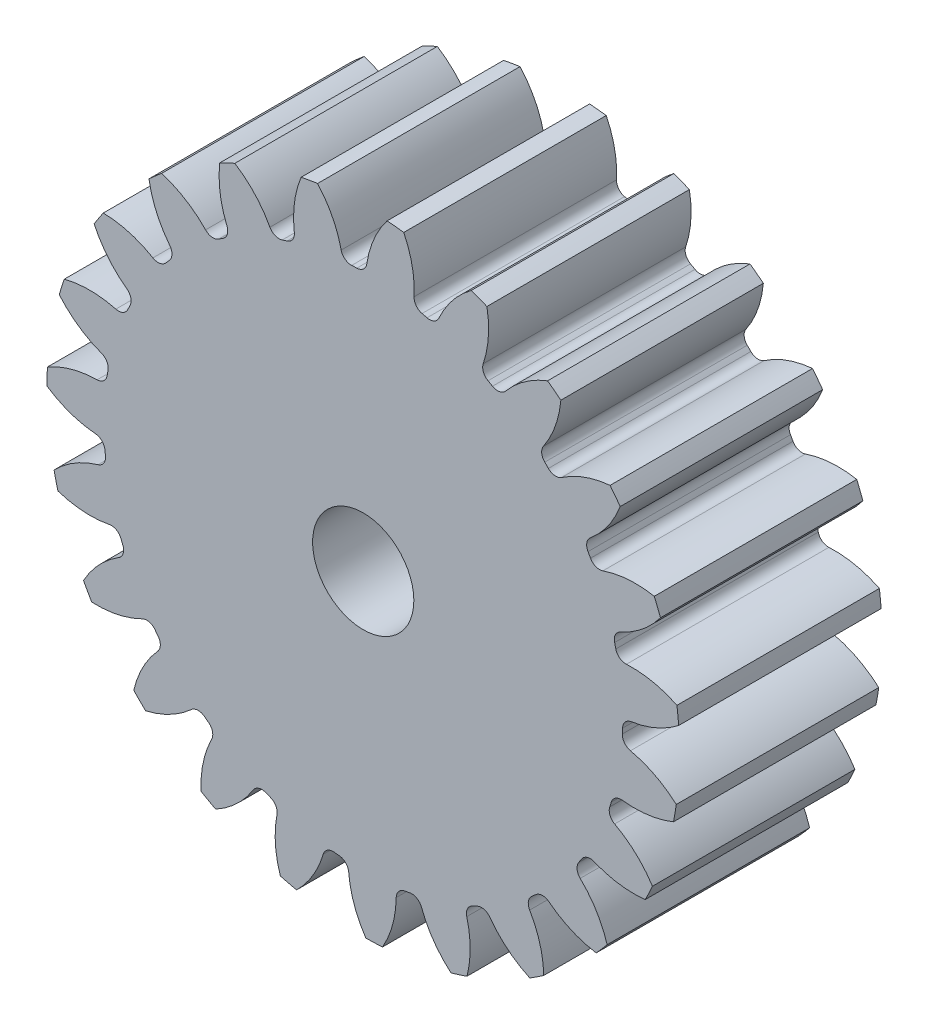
SolidWorks part; units mm, degrees
ref_plane "Front" through (0, 0, 0) normal (0, 0, 1) x (1, 0, 0)
ref_plane "Top" through (0, 0, 0) normal (0, 1, 0) x (1, 0, 0)
ref_plane "Right" through (0, 0, 0) normal (1, 0, 0) x (0, 0, -1)
sketch "Sketch3" plane through (0, 0, 0) normal (0, 0, 1) x (1, 0, 0)
  circle A0 centre (0, 0) radius 158.75
  dimension "od" = 317.5
extrude "gearBody" add sketch "Sketch3" along normal blind 101.6
sketch "Sketch2" plane through (0, 0, 0) normal (0, 0, 1) x (1, 0, 0)
  line L0 (0, 0) -> (126.7952, 52.5203) construction
  line L1 (157.546, -23.1648) -> (0, 0) construction
  line L2 (0, 0) -> (36.3143, 0) construction
  line L3 (145.9639, 5.0149) -> (145.2928, -14.8523) construction
  line L5 (145.6284, -4.9187) -> (0, 0) construction
  line L7 (0, 0) -> (137.2421, 0) construction
  arc A0 (137.2217, 2.3656) -> (136.7494, -11.6192) centre (0, 0) ccw construction
  arc A1 (158.2869, 12.1164) -> (157.1086, -22.7692) centre (0, 0) ccw construction
  arc A2 (145.9639, 5.0149) -> (145.2928, -14.8523) centre (0, 0) ccw construction
  arc A3 (130.0509, -5.6817) -> (130.1379, -3.1065) centre (0, 0) ccw
  arc A4 (157.546, -23.1648) -> (134.0919, -10.9527) centre (122.9624, -60.9561) ccw
  arc A5 (157.546, -23.1648) -> (158.75, 12.4816) centre (0, 0) ccw
  arc A6 (158.75, 12.4816) -> (134.5254, 1.8799) centre (126.7952, 52.5203) cw
  arc A7 (130.1379, -3.1065) -> (134.5254, 1.8799) centre (135.3054, -3.2298) cw
  arc A8 (134.0919, -10.9527) -> (130.0509, -5.6817) centre (135.2149, -5.9073) cw
  point P6 (158.75, 12.4816)
  point P22 (157.546, -23.1648)
  dimension "baseDia" = 274.4842
  dimension "od" = 317.5
  dimension "pd" = 292.1
  dimension "rd" = 260.35
  dimension "rFillet" = 5.1689
  dimension "pointX" = 158.75
  dimension "pointY" = 12.4816
  dimension "CTT" = 19.8672
  dimension "flankCenterAngle" = 22.5
extrude "toothCut" cut sketch "Sketch2" along normal through all
pattern_circular "CirPattern1" count 23 over 360 about axis through (0, 0, 0) along (0, 0, 1) of "toothCut"
sketch "hub1Dia" plane through (0, 0, 0) normal (0, 0, -1) x (-1, 0, 0)
  circle A0 centre (0, 0) radius 12.7
  dimension "hub1Dia" = 25.4
sketch "hub2Dia" plane through (0, 0, 101.6) normal (0, 0, 1) x (1, 0, 0)
  circle A0 centre (0, 0) radius 12.7
  dimension "hub2dia" = 25.4
sketch "boreDia" plane through (0, 0, 0) normal (0, 0, 1) x (1, 0, 0)
  circle A0 centre (0, 0) radius 25.4
  dimension "boreDia" = 50.8
extrude "bore" cut sketch "boreDia" against normal mid plane 25400
